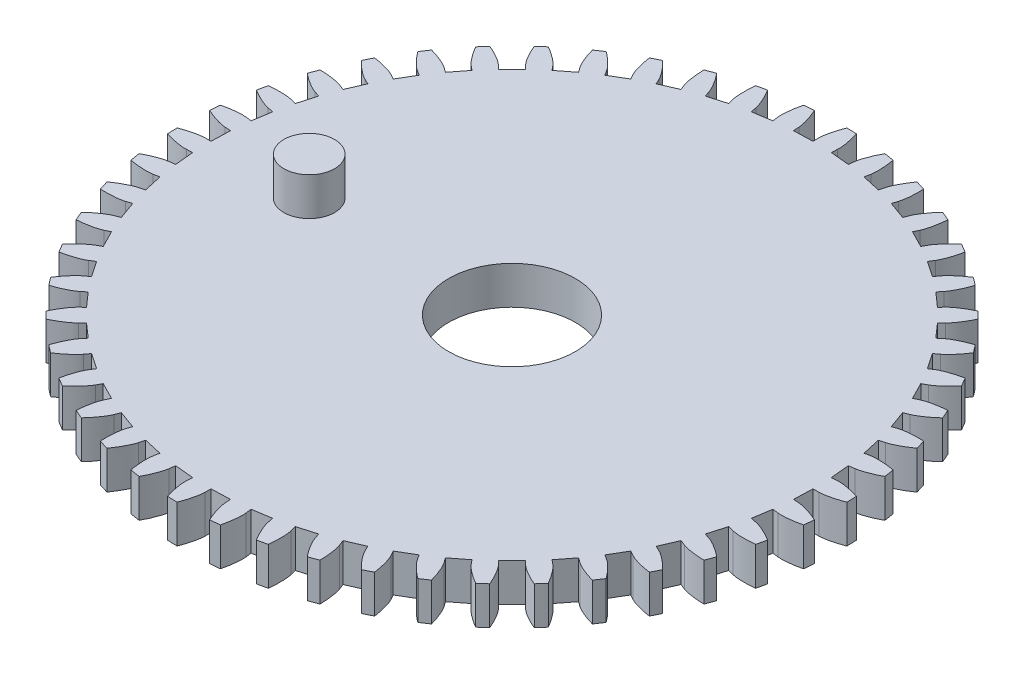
SolidWorks part; units mm, degrees
ref_plane "Front Plane" through (0, 0, 0) normal (0, 0, 1) x (1, 0, 0)
ref_plane "Top Plane" through (0, 0, 0) normal (0, 1, 0) x (1, 0, 0)
ref_plane "Right Plane" through (0, 0, 0) normal (1, 0, 0) x (0, 0, -1)
sketch "Sketch1" plane through (0, 0, 0) normal (0, 1, 0) x (1, 0, 0)
  line L0 (0, 0) -> (0, 12.1018) construction
  line L1 (0, 0) -> (-12.1018, 0) construction
  line L2 (0, 0) -> (-12.9936, -0.4083) construction
  line L3 (0, 0) -> (-12.078, -0.7599) construction
  line L4 (0, 0) -> (-12.0064, -1.5168) construction
  circle A0 centre (0, 0) radius 12.5 construction
  circle A1 centre (0, 0) radius 12.1018 construction
  circle A2 centre (0, 0) radius 11.875 construction
  circle A3 centre (0, 0) radius 13 construction
  spline S0 degree 4 poles (-12.1018, 0) (-12.123, 0) (-12.1825, -0.0022) (-12.2944, -0.0149) (-12.4752, -0.0478) (-12.7022, -0.1074) (-12.9902, -0.2042) (-13.3209, -0.3434) (-13.6737, -0.522) (-14.0442, -0.7428) (-14.4007, -0.9862) (-14.743, -1.2493) (-15.0712, -1.5296) (-15.4524, -1.8888) (-15.8861, -2.3482) (-16.356, -2.92) (-16.8432, -3.6138) (-17.2872, -4.3547) (-17.6802, -5.1234) (-17.9804, -5.8172) (-18.2073, -6.4229) (-18.3766, -6.936) (-18.5002, -7.3476) (-18.6404, -7.8721) (-18.7611, -8.3914) (-18.8636, -8.9309) (-18.9638, -9.5554) (-19.0305, -10.1179) (-19.077, -10.6083) (-19.1144, -11.2989) (-19.1236, -11.6543) (-19.1283, -12.2081) (-19.1183, -12.4606) (-19.114, -12.6843) (-19.1097, -12.7514) (-19.108, -12.7998) (-19.1071, -12.8259) knots 0 0 0 0 0 0.005377 0.015084 0.028532 0.04661 0.064855 0.092111 0.119476 0.146842 0.174209 0.201575 0.228941 0.256307 0.307035 0.361767 0.4165 0.471232 0.525964 0.580697 0.608063 0.635429 0.662795 0.690161 0.744894 0.77226 0.799626 0.854358 0.881725 0.909091 0.954545 0.977273 0.988636 0.994318 1 1 1 1 1 construction
  spline S1 degree 4 poles (-12.1018, 0) (-12.123, 0) (-12.1825, -0.0022) (-12.2944, -0.0149) (-12.4752, -0.0478) (-12.7022, -0.1074) (-12.9902, -0.2042) (-13.3209, -0.3434) (-13.6737, -0.522) (-14.0442, -0.7428) (-14.4007, -0.9862) (-14.743, -1.2493) (-15.0712, -1.5296) (-15.4524, -1.8888) (-15.8861, -2.3482) (-16.356, -2.92) (-16.8432, -3.6138) (-17.2872, -4.3547) (-17.6802, -5.1234) (-17.9804, -5.8172) (-18.2073, -6.4229) (-18.3766, -6.936) (-18.5002, -7.3476) (-18.6404, -7.8721) (-18.7611, -8.3914) (-18.8636, -8.9309) (-18.9638, -9.5554) (-19.0305, -10.1179) (-19.077, -10.6083) (-19.1034, -11.0963) (-19.1117, -11.2934) (-19.1149, -11.3914) knots 0 0 0 0 0 0.005377 0.015084 0.028532 0.04661 0.064855 0.092111 0.119476 0.146842 0.174209 0.201575 0.228941 0.256307 0.307035 0.361767 0.4165 0.471232 0.525964 0.580697 0.608063 0.635429 0.662795 0.690161 0.744894 0.77226 0.799626 0.854358 0.881725 0.909091 0.909091 0.909091 0.909091 0.909091
  dimension "D1" = 26
  dimension "D2" = 25
  dimension "D3" = 24.2037
  dimension "D4" = 23.75
  dimension "D5" = 12.1018
  dimension "D6" = 1.8
  dimension "D7" = 3.6
  dimension "D8" = 7.2
sketch "Sketch2" plane through (0, 0, 0) normal (0, 1, 0) x (1, 0, 0)
  line L0 (0, 0) -> (-12.9936, -0.4083) construction
  line L1 (0, 0) -> (-12.9936, -0.4083) construction
  line L2 (0, 0) -> (-12.078, -0.7599) construction
  line L3 (0, 0) -> (-12.1018, 0) construction
  line L4 (0, 0) -> (-12.0064, -1.5168) construction
  line L5 (0, 0) -> (-12.078, -0.7599) construction
  line L6 (0, 0) -> (-12.1018, 0) construction
  line L7 (0, 0) -> (-12.0064, -1.5168) construction
  line L8 (-12.078, -0.7599) -> (-11.8516, -0.7456)
  line L9 (-11.8516, -0.7456) -> (-11.7814, -1.4883)
  line L10 (-11.7814, -1.4883) -> (-12.0064, -1.5168) construction
  line L11 (-11.7814, -1.4883) -> (-2.4803, -0.3133)
  line L12 (-12.1018, 0) -> (-2.5, 0)
  circle A0 centre (0, 0) radius 11.875 construction
  circle A1 centre (0, 0) radius 12.1018 construction
  circle A2 centre (0, 0) radius 12.5 construction
  circle A3 centre (0, 0) radius 13 construction
  circle A4 centre (0, 0) radius 11.875 construction
  circle A5 centre (0, 0) radius 12.1018 construction
  circle A6 centre (0, 0) radius 12.5 construction
  circle A7 centre (0, 0) radius 13 construction
  arc A8 (-12.986, -0.6039) -> (-12.9983, -0.2127) centre (0, 0) cw
  circle A11 centre (0, 0) radius 2.5 construction
  arc A12 (-2.5, 0) -> (-2.4803, -0.3133) centre (0, 0) ccw
  spline S0 degree 4 poles (-72.4365, -1998.9619) (-8.5514, -39.6205) (-9.2103, -0.8348) (-10.9161, 0.2359) (-12.4752, -0.0478) (-12.7022, -0.1074) (-12.9902, -0.2042) (-13.3209, -0.3434) (-13.6737, -0.522) (-14.0442, -0.7428) (-14.4007, -0.9862) (-14.743, -1.2493) (-15.0712, -1.5296) (-15.4524, -1.8888) (-15.8861, -2.3482) (-16.356, -2.92) (-16.8432, -3.6138) (-17.2872, -4.3547) (-17.6802, -5.1234) (-17.9804, -5.8172) (-18.2073, -6.4229) (-18.3766, -6.936) (-18.5002, -7.3476) (-18.6404, -7.8721) (-18.7611, -8.3914) (-18.8636, -8.9309) (-18.9638, -9.5554) (-19.0305, -10.1179) (-19.2372, -12.2989) (-19.1319, -17.0789) (-16.744, 39.3584) (-84.0555, -2010.1845) knots -0.35521 -0.35521 -0.35521 -0.35521 -0.35521 0.005377 0.015084 0.028532 0.04661 0.064855 0.092111 0.119476 0.146842 0.174209 0.201575 0.228941 0.256307 0.307035 0.361767 0.4165 0.471232 0.525964 0.580697 0.608063 0.635429 0.662795 0.690161 0.744894 0.77226 0.799626 0.854358 0.881725 1.380796 1.380796 1.380796 1.380796 1.380796 only from (-12.1018, 0) to (-19.1149, -11.3914) construction
  spline S1 degree 4 poles (-12.1018, 0) (-12.123, 0) (-12.1825, -0.0022) (-12.2944, -0.0149) (-12.4752, -0.0478) (-12.6787, -0.1012) (-12.8422, -0.1547) (-12.9538, -0.1957) (-12.9983, -0.2127) knots 0 0 0 0 0 0.005377 0.015084 0.028532 0.04661 0.058695 0.058695 0.058695 0.058695 0.058695
  spline S2 degree 4 poles (-12.078, -0.7599) (-12.0991, -0.7612) (-12.1586, -0.7628) (-12.271, -0.7571) (-12.4536, -0.7356) (-12.6601, -0.6951) (-12.8266, -0.652) (-12.9405, -0.6181) (-12.986, -0.6039) knots 0 0 0 0 0 0.005377 0.015084 0.028532 0.04661 0.058695 0.058695 0.058695 0.058695 0.058695
  point P21 (-11.8516, -0.7456)
  point P24 (-11.7814, -1.4883)
  dimension "D2" = 5
extrude "Boss-Extrude1" add sketch "Sketch2" along normal blind 1.5
pattern_circular "CirPattern1" count 50 over 360 of "Boss-Extrude1"
sketch "Sketch3" plane through (0, 1.5, 0) normal (0, 1, 0) x (1, 0, 0)
  circle A0 centre (-8, 0) radius 1
  point P2 (0, 0)
  dimension "D1" = 2
  dimension "D2" = 8
extrude "Boss-Extrude2" add sketch "Sketch3" along normal blind 1.5
equation "\"Module\"= .5"
equation "\"Number of Teeth\"= 50"
equation "\"Pressure Angle\"= 14.5deg"
equation "\"Pitch Diameter\"= \"Number of Teeth\" * \"Module\""
equation "\"Circular Pitch\"= pi * \"Module\""
equation "\"Addendum\"= \"Module\""
equation "\"Dedendum\"= 1.25 * \"Module\""
equation "\"Base Diameter\"= \"Pitch Diameter\" * cos ( \"Pressure Angle\" )"
equation "\"Base Radius\"= \"Base Diameter\" / 2"
equation "\"Width\"= 1.5"
equation "\"Outside Diameter\"= \"Pitch Diameter\" + 2 * \"Addendum\""
equation "\"D1@Sketch1\"=\"Outside Diameter\""
equation "\"D3@Sketch1\"=\"Base Diameter\""
equation "\"Root Diameter\"= \"Pitch Diameter\" - 2 * \"Dedendum\""
equation "\"D4@Sketch1\"=\"Root Diameter\""
equation "\"Tooth Angle\"= 360 / \"Number of Teeth\""
equation "\"D6@Sketch1\"=\"Tooth Angle\"/4"
equation "\"D7@Sketch1\"=\"Tooth Angle\"/2"
equation "\"D8@Sketch1\"=\"Tooth Angle\""
equation "\"D2@Sketch1\" = \"Pitch Diameter\""
equation "\"Shaft Diameter\"= 5"
equation "\"D1@CirPattern1\" = \"Number of Teeth\""
equation "\"D2@Sketch2\"= \"Shaft Diameter\""
equation "\"D1@Boss-Extrude1\" = \"Width\""
